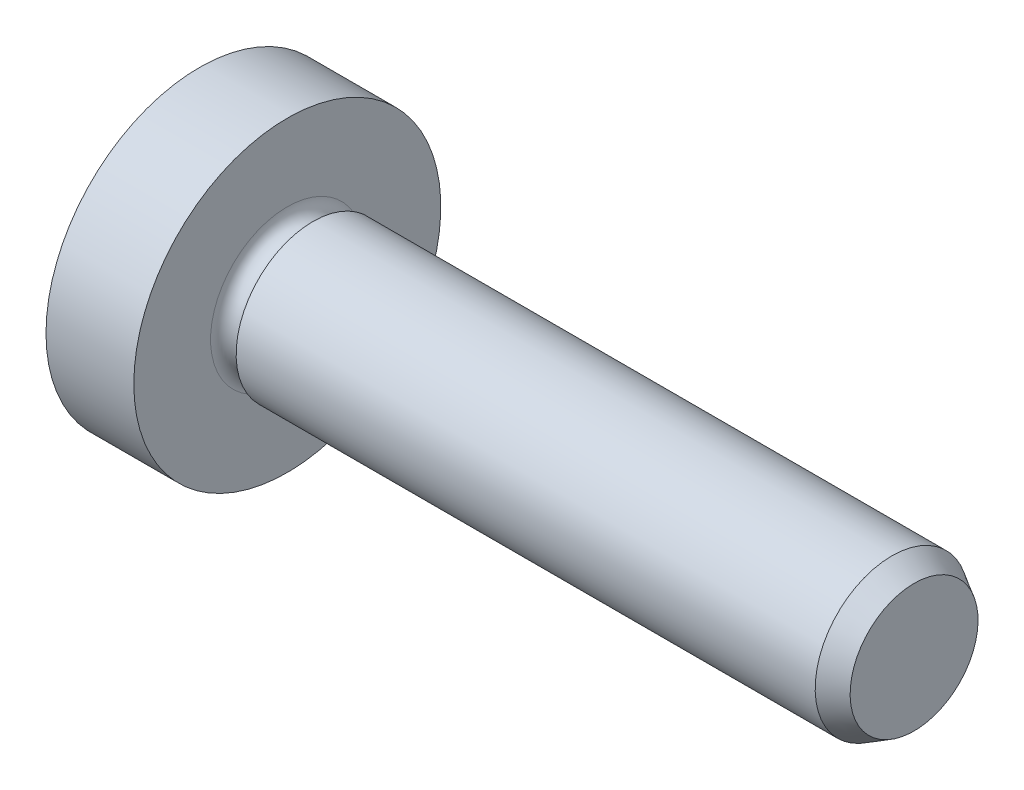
SolidWorks part; units mm, degrees
ref_plane "Front" through (0, 0, 0) normal (0, 0, 1) x (1, 0, 0)
ref_plane "Top" through (0, 0, 0) normal (0, 1, 0) x (1, 0, 0)
ref_plane "Right" through (0, 0, 0) normal (1, 0, 0) x (0, 0, -1)
sketch "Sketch1" plane through (0, 0, 0) normal (0, 0, 1) x (1, 0, 0)
  line L0 (-96.3852, 0) -> (11.3165, 0) construction
  line L1 (29.1, 0) -> (29.1, 3)
  line L2 (29.1, 3) -> (4.6, 3)
  line L3 (4.6, 3) -> (4.6, 6)
  line L4 (4.6, 6) -> (1.1676, 6)
  line L5 (29.1, 0) -> (0, 0)
  arc A0 (1.1676, 6) -> (0, 0) centre (16, 0) ccw
  dimension "rf" = 16
  dimension "st" = 6
  dimension "k" = 4.6
  dimension "l" = 24.5
  dimension "dk" = 12
revolve "Base" add sketch "Sketch1" angle 360 about L0
sketch "Sketch2" plane through (0, 0, 0) normal (1, 0, 0) x (0, 0, -1)
  line L0 (6.5369, 0) -> (-7.0008, 0) construction
  line L1 (0, 6.811) -> (0, -6.4314) construction
  line L2 (-0.69, 3.45) -> (0.69, 3.45)
  line L3 (0.69, 3.45) -> (0.69, 0.69)
  line L4 (0.69, 0.69) -> (3.45, 0.69)
  line L5 (3.45, 0.69) -> (3.45, -0.69)
  line L6 (0.69, -0.69) -> (3.45, -0.69)
  line L7 (0.69, -3.45) -> (0.69, -0.69)
  line L8 (-0.69, -3.45) -> (0.69, -3.45)
  line L9 (-0.69, -3.45) -> (-0.69, -0.69)
  line L10 (-0.69, -0.69) -> (-3.45, -0.69)
  line L11 (-3.45, 0.69) -> (-3.45, -0.69)
  line L12 (-0.69, 0.69) -> (-3.45, 0.69)
  line L13 (-0.69, 3.45) -> (-0.69, 0.69)
  point P5 (-3.45, 0)
  point P11 (3.45, 0)
  point P15 (0, -3.45)
  point P20 (0, 3.45)
  dimension "m" = 6.9
  dimension "D2" = 6.9
  dimension "D3" = 1.38
  dimension "D4" = 1.38
extrude "CrossRecess" cut sketch "Sketch2" along normal blind 3.1
draft "Draft1" type of draft neutral plane draft angle 30 neutral plane "Right" faces to draft 4 parameters "D1"=30
sketch "Sketch6" plane through (0, 0, 0) normal (0, 0, 1) x (1, 0, 0)
  line L0 (30.9483, 0) -> (0, 0) construction
  line L1 (29.1, -3) -> (29.1, 3) construction
  line L2 (28.234, -3) -> (29.1, -2.5)
  line L6 (29.1, -2.5) -> (29.1, -3)
  line L7 (29.1, -3) -> (28.234, -3)
  dimension "D1" = 30
  dimension "D2" = 5
  dimension "D3" = 6
revolve "BaseEnd" cut sketch "Sketch6" angle 360 about L0
sketch "Sketch4" plane through (0, 0, 0) normal (0, 1, 0) x (1, 0, 0)
  line L0 (14.876, 0) -> (0, 0) construction
  line L2 (4.6, 3) -> (5.6, 3)
  arc A0 (5.6, 3) -> (4.6, 3) centre (5.1, 3) cw
  dimension "a1" = 1
revolve "Cut-Revolve2" cut sketch "Sketch4" angle 360 about L0
sketch "Sketch7" plane through (0, 0, 0) normal (0, 0, 1) x (1, 0, 0)
  line L0 (0, 0) -> (30.1311, 0) construction
  line L1 (28.0896, 3.2887) -> (28.3783, 3.2887)
  line L2 (28.3783, 3.2887) -> (28.3783, 3)
  line L3 (28.3783, 3) -> (28.234, 2.75)
  line L4 (28.234, 2.75) -> (28.0896, 3)
  line L5 (28.0896, 3) -> (28.0896, 3.2887)
  line L6 (28.234, 3) -> (28.234, -3) construction
  dimension "D1" = 6
  dimension "D2" = 5.5
revolve "Cut-Revolve10" [suppressed] cut sketch "Sketch7" angle 360 about L0
pattern_linear "LPattern10" [suppressed] count 63 spacing 0.375 along (1, 0, 0)
sketch "Sketch5" plane through (0, 0, 0) normal (0, 1, 0) x (1, 0, 0)
  line L0 (12.8957, 0) -> (-1.3597, 0) construction
  line L3 (4.6, 3) -> (14.1857, 3)
  line L4 (4.6, 3) -> (4.6, 2.9988)
  line L5 (4.8488, 2.75) -> (11.6857, 2.75)
  line L6 (11.6857, 2.75) -> (14.1857, 3)
  line L8 (29.1, -3) -> (29.1, 3) construction
  line L9 (4.6, -6) -> (4.6, 6) construction
  arc A0 (4.6, 2.9988) -> (4.8488, 2.75) centre (4.8488, 2.9988) ccw
  dimension "D3" = 0.2488
  dimension "D1" = 6
  dimension "D2" = 5.5
  dimension "x" = 2.5
  dimension "b" = 14.9143
revolve "Cut-Revolve3" [suppressed] cut sketch "Sketch5" angle 360 about L0
equation "\"D3@Sketch2\" = \"m@Sketch2\" / 5"
equation "\"D4@Sketch2\" = \"D3@Sketch2\""
equation "\"D2@Sketch2\" = \"m@Sketch2\""
equation "\"D2@ThreadCosmetic1\" = \"st@Sketch1\" - 1"
equation "\"D2@Sketch5\" = \"D2@ThreadCosmetic1\"+0.5"
equation "\"D2@Sketch6\" = \"D2@ThreadCosmetic1\""
equation "\"D1@Sketch5\" = \"st@Sketch1\""
equation "\"D3@Sketch6\" = \"st@Sketch1\""
equation "\"D3@Sketch5\" =  ( \"D1@Sketch5\" - \"D2@Sketch5\" )  / 2.01"
equation "\"D2@Sketch7\" = \"D2@ThreadCosmetic1\"+0.5"
equation "\"D1@Sketch7\" = \"st@Sketch1\""
equation "\"D3@LPattern10\" =  ( \"D1@Sketch7\" - \"D2@Sketch7\" )  / 2 * 1.5"
equation "\"D1@LPattern10\" = (  \"l@Sketch1\" - ( \"D3@Sketch6\"- \"D2@Sketch6\" )  / 2 *  1.732   )  / \"D3@LPattern10\""
